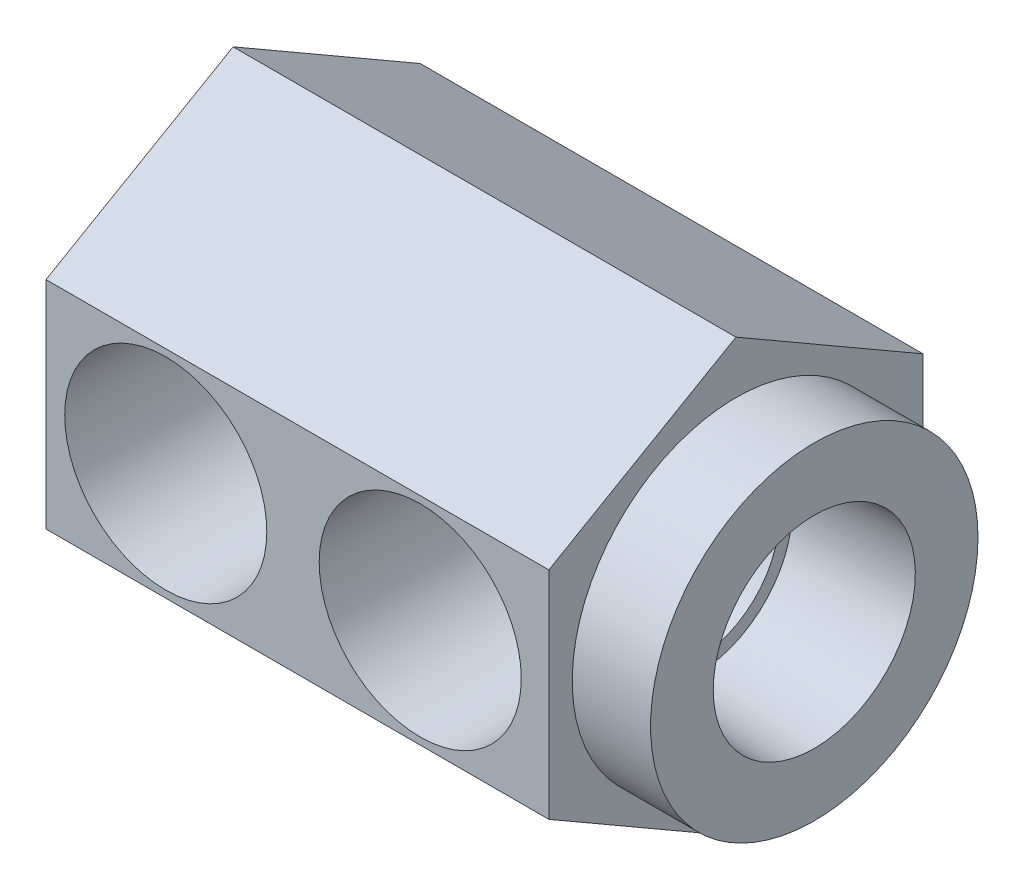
SolidWorks part; units mm, degrees
ref_plane "Front Plane" through (0, 0, 0) normal (0, 0, 1) x (1, 0, 0)
ref_plane "Top Plane" through (0, 0, 0) normal (0, 1, 0) x (1, 0, 0)
ref_plane "Right Plane" through (0, 0, 0) normal (1, 0, 0) x (0, 0, -1)
sketch "Sketch2" plane through (0, 0, 0) normal (1, 0, 0) x (0, 0, -1)
  line L0 (0, 16.1312) -> (0, -16.1312) construction
  line L1 (-12.7, -7.3323) -> (0, -14.6647)
  line L2 (0, -14.6647) -> (12.7, -7.3323)
  line L3 (12.7, -7.3323) -> (12.7, 7.3323)
  line L4 (12.7, 7.3323) -> (0, 14.6647)
  line L5 (0, 14.6647) -> (-12.7, 7.3323)
  line L6 (-12.7, 7.3323) -> (-12.7, -7.3323)
  circle A0 centre (0, 0) radius 12.7 construction
  dimension "D1" = 25.4
extrude "Boss-Extrude1" add sketch "Sketch2" along normal blind 34.1313 separate body
sketch "Sketch3" plane through (34.1313, 0, 0) normal (1, 0, 0) x (0, 0, -1)
  circle A1 centre (0, 0) radius 11.1125
  dimension "D1" = 22.225
extrude "Boss-Extrude2" add sketch "Sketch3" along normal blind 5.3162
sketch "Sketch4" plane through (0, 0, 0) normal (0, 1, 0) x (1, 0, 0)
  line L1 (39.4475, 6.8593) -> (31.51, 6.4433)
  line L3 (31.51, 5.5562) -> (31.51, 6.4433)
  line L5 (39.4475, 0) -> (39.4475, 6.8593)
  line L6 (-12.2162, 0) -> (49987.7838, 0) construction
  line L7 (29.9225, 5.5562) -> (31.51, 5.5562)
  line L8 (29.9225, 5.5562) -> (29.9225, 0)
  line L9 (29.9225, 0) -> (39.4475, 0)
  line L10 (39.4475, -11.1125) -> (39.4475, 11.1125) construction
  dimension "D1" = 11.1125
  dimension "D2" = 3
  dimension "D3" = 7.9375
  dimension "D4" = 9.525
  dimension "D5" = 13.7185
revolve "Cut-Revolve1" cut sketch "Sketch4" angle 360 about L6
hole_wizard "1/4 NPT Tapped Hole1" positions "Sketch6" profile "Sketch5" size "1/4" standard "Ansi Inch"
sketch "Sketch6" plane through (0, 0, -12.7) normal (0, 0, -1) x (-1, 0, 0)
  line L0 (13.97, 0) -> (-13.97, 0) construction
  line L1 (0, 13.97) -> (0, -13.97) construction
  point P0 (-8.128, 0)
  dimension "D1" = 8.128
sketch "Sketch5" plane through (8.128, 0, -12.7) normal (1, 0, 0) x (0, 1, 0)
  line L0 (0, 0) -> (0, 20.4111)
  line L1 (5.5626, 17.0688) -> (0, 20.4111)
  line L2 (-5.5626, 17.0688) -> (0, 20.4111) construction
  line L3 (5.5626, 17.0688) -> (5.5626, 10.0203)
  line L4 (5.5626, 10.0203) -> (6.558, 10.0203)
  line L5 (6.558, 10.0203) -> (6.858, 0)
  line L6 (-6.558, 10.0203) -> (-6.858, 0) construction
  line L7 (6.858, 0) -> (0, 0)
  line L8 (0, -6.35) -> (0, 107.95) construction
  line L11 (-5.5626, 10.0203) -> (-6.558, 10.0203) construction
  dimension "Tap Drill Dia." = 11.1252
  dimension "Tap Drill Depth" = 17.0688
  dimension "Thread Dia." = 13.716
  dimension "Thread Angle" = 3.43
  dimension "Thread Depth" = 10.0203
  dimension "Drill Angle" = 118
hole_wizard "1/4 NPT Tapped Hole2" positions "Sketch8" profile "Sketch7" size "1/4" standard "Ansi Inch"
sketch "Sketch8" plane through (0, 0, 12.7) normal (0, 0, 1) x (1, 0, 0)
  line L0 (0, -13.97) -> (0, 13.97) construction
  circle A0 centre (8.128, 0) radius 6.858 construction
  point P0 (8.128, 0)
  point P1 (25.4, 0)
  dimension "D1" = 25.4
sketch "Sketch7" plane through (8.128, 0, 12.7) normal (1, 0, 0) x (0, -1, 0)
  line L0 (0, 0) -> (0, 20.4111)
  line L1 (5.5626, 17.0688) -> (0, 20.4111)
  line L2 (-5.5626, 17.0688) -> (0, 20.4111) construction
  line L3 (5.5626, 17.0688) -> (5.5626, 10.0203)
  line L4 (5.5626, 10.0203) -> (6.558, 10.0203)
  line L5 (6.558, 10.0203) -> (6.858, 0)
  line L6 (-6.558, 10.0203) -> (-6.858, 0) construction
  line L7 (6.858, 0) -> (0, 0)
  line L8 (0, -6.35) -> (0, 107.95) construction
  line L11 (-5.5626, 10.0203) -> (-6.558, 10.0203) construction
  dimension "Tap Drill Dia." = 11.1252
  dimension "Tap Drill Depth" = 17.0688
  dimension "Thread Dia." = 13.716
  dimension "Thread Angle" = 3.43
  dimension "Thread Depth" = 10.0203
  dimension "Drill Angle" = 118
hole_wizard "7/32 (0.21875) Diameter Hole1" positions "Sketch10" profile "Sketch9" hole size "7/32" standard "Ansi Inch"
sketch "Sketch10" plane through (39.4475, 0, 0) normal (1, 0, 0) x (0, 0, -1)
  circle A0 centre (0, 0) radius 6.8593 construction
  point P0 (0, 0)
sketch "Sketch9" plane through (39.4475, 0, 0) normal (0, 1, 0) x (0, 0, -1)
  line L0 (0, 0) -> (0, 33.4193)
  line L1 (0, 33.4193) -> (2.7781, 31.75)
  line L2 (2.7781, 31.75) -> (2.7781, 0)
  line L5 (2.7781, 0) -> (0, 0)
  line L10 (0, 33.4193) -> (-2.7781, 31.75) construction
  line L11 (0, -6.35) -> (0, 107.95) construction
  dimension "Hole Dia." = 5.5562
  dimension "Hole Depth" = 31.75
  dimension "Drill Angle" = 118
hole_wizard "1/4 (0.25) Diameter Hole1" positions "Sketch12" profile "Sketch11" hole size "1/4" standard "Ansi Inch"
sketch "Sketch12" plane through (39.4475, 0, 0) normal (1, 0, 0) x (0, 0, -1)
  circle A0 centre (0, 0) radius 6.8593 construction
  point P0 (0, 0)
sketch "Sketch11" plane through (39.4475, 0, 0) normal (0, 1, 0) x (0, 0, -1)
  line L0 (0, 0) -> (0, 29.3397)
  line L1 (0, 29.3397) -> (3.175, 27.432)
  line L2 (3.175, 27.432) -> (3.175, 0)
  line L5 (3.175, 0) -> (0, 0)
  line L10 (0, 29.3397) -> (-3.175, 27.432) construction
  line L11 (0, -6.35) -> (0, 107.95) construction
  dimension "Hole Dia." = 6.35
  dimension "Hole Depth" = 27.432
  dimension "Drill Angle" = 118
